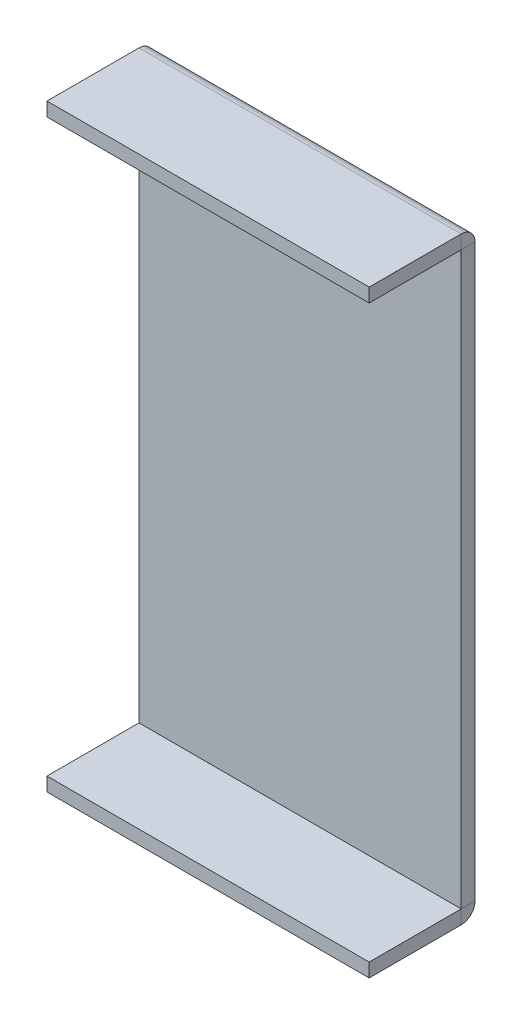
SolidWorks part; units mm, degrees
ref_plane "Alzado" through (0, 0, 0) normal (0, 0, 1) x (1, 0, 0)
ref_plane "Planta" through (0, 0, 0) normal (0, 1, 0) x (1, 0, 0)
ref_plane "Vista lateral" through (0, 0, 0) normal (1, 0, 0) x (0, 0, -1)
sketch "Croquis1" plane through (0, 0, 0) normal (1, 0, 0) x (0, 0, -1)
  line L0 (-23, 63) -> (-23, 60)
  line L1 (-23, 63) -> (0, 63)
  line L2 (-23, 60) -> (-3, 60)
  line L3 (-23, -67) -> (0, -67)
  line L4 (0, 63) -> (0, -67)
  line L5 (-23, -67) -> (-23, -64)
  line L6 (-23, -64) -> (-3, -64)
  line L7 (-3, -64) -> (-3, 60)
extrude "Extruir1" add sketch "Croquis1" along normal blind 70
sheet metal parameters "Chapa metálica1" parameters "D1"=0.7366, "Espesor"=3
bend "Pliegue de arista viva2" bend angle 90 parameters "D1"=0, "D5"=1
flatten bends "Desplegar pliegues1" parameters "D1"=0
sketch "Croquis de arista viva1" plane through (0, 0, 3) normal (0, 0, 1) x (1, 0, 0)
  line L0 (70, 63) -> (0, 63) construction
  line L1 (0, -67) -> (70, -67) construction
bend "Pliegue de arista viva1" bend angle 90 parameters "D1"=0, "D5"=2
process bends "Procesar pliegues1" parameters "D1"=0
sketch "Croquis desplegado1" plane through (0, 0, 3) normal (0, 0, 1) x (1, 0, 0)
flat pattern "Chapa desplegada1"
sketch "Líneas de pliegue1" plane through (0, 0, 3) normal (0, 0, 1) x (1, 0, 0)
  line L0 (80, -67) -> (0, -67) construction
  line L1 (0, 63) -> (80, 63) construction
  line L2 (80, -67) -> (0, -67) construction
  line L3 (0, 63) -> (80, 63) construction
bend of the flat pattern "Aplanar-<Pliegue de arista viva1>1"
bend of the flat pattern "Aplanar-<Pliegue de arista viva2>1"
